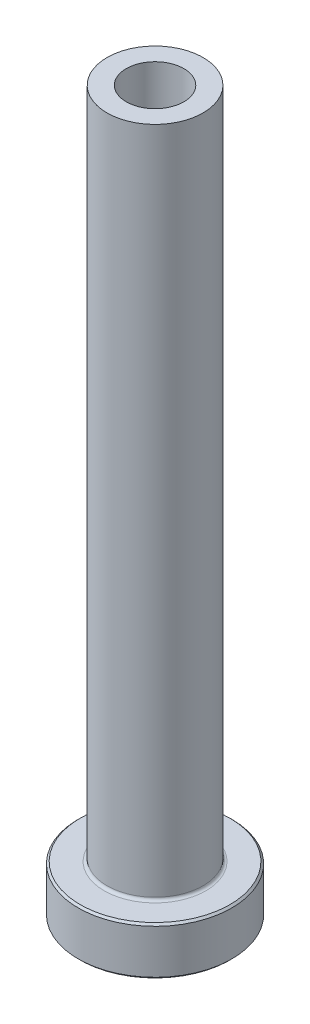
SolidWorks part; units mm, degrees
ref_plane "Front Plane" through (0, 0, 0) normal (0, 0, 1) x (1, 0, 0)
ref_plane "Top Plane" through (0, 0, 0) normal (0, 1, 0) x (1, 0, 0)
ref_plane "Right Plane" through (0, 0, 0) normal (1, 0, 0) x (0, 0, -1)
sketch "Sketch1" plane through (0, 0, 0) normal (0, 0, 1) x (1, 0, 0)
  line L0 (-3, 75) -> (-5, 75)
  line L1 (-5, 75) -> (-5, 5)
  line L2 (-5, 5) -> (-8, 5)
  line L3 (-8, 5) -> (-8, 0)
  line L4 (8.8, 0) -> (-8.8, 0) construction
  line L5 (-8, 0) -> (-3.25, 0)
  line L6 (-3, 30) -> (-3, 75)
  line L7 (0, 92.1877) -> (0, -15.5353) construction
  line L8 (0, -8.8) -> (0, 8.8) construction
  line L9 (-3, 30) -> (-3.25, 18)
  line L10 (-3.25, 18) -> (-3.25, 0)
  dimension "D1" = 0.25
  dimension "ID" = 6
  dimension "OD" = 10
  dimension "L" = 75
  dimension "H" = 16
  dimension "T" = 5
  dimension "N" = 45
  dimension "D2" = 12
revolve "Revolve1" add sketch "Sketch1" angle 360 about L7
fillet "Fillet1" radius 0.3 1 edges at (0, 5, 5)
chamfer "Chamfer1" distance 0.2 angle 45 2 edges at (0, 5, 8) (0, 0, 8)
chamfer "Chamfer3" distance 0.5 angle 45 1 edges at (0, 0, 3.25)
